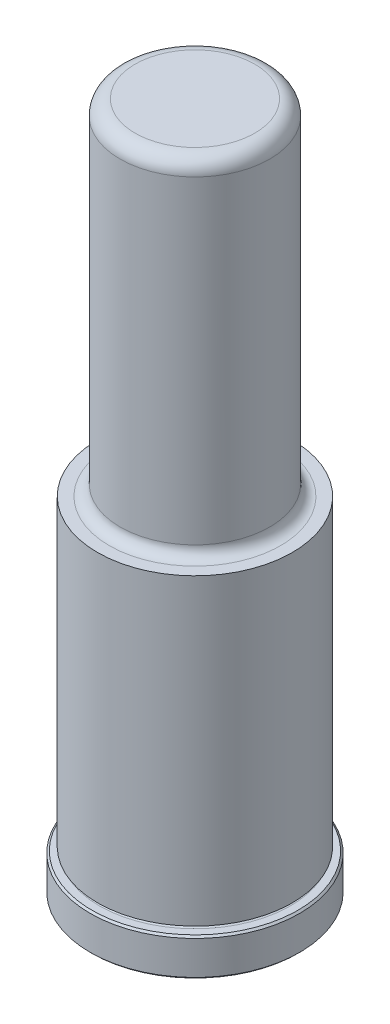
SolidWorks part; units mm, degrees
ref_plane "Front Plane" through (0, 0, 0) normal (0, 0, 1) x (1, 0, 0)
ref_plane "Top Plane" through (0, 0, 0) normal (0, 1, 0) x (1, 0, 0)
ref_plane "Right Plane" through (0, 0, 0) normal (1, 0, 0) x (0, 0, -1)
sketch "Sketch1" plane through (0, 0, 0) normal (1, 0, 0) x (0, 0, -1)
  line L0 (0, 0) -> (22.225, 0)
  line L1 (22.225, 0) -> (22.225, 7.9248)
  line L2 (22.225, 7.9248) -> (20.2438, 7.9248)
  line L3 (19.8628, 2.6782) -> (19.8628, 5.9795) construction
  line L4 (20.2438, 8.6868) -> (20.6502, 8.6868)
  line L5 (20.6502, 8.6868) -> (20.6502, 73.025)
  line L6 (20.6502, 73.025) -> (18.1483, 73.025)
  line L7 (15.8623, 75.311) -> (15.8623, 146.05)
  line L9 (15.8623, 146.05) -> (0, 146.05)
  line L10 (0, 146.05) -> (0, 0)
  line L11 (0, 0) -> (0, -7.2694) construction
  arc A0 (20.2438, 8.6868) -> (20.2438, 7.9248) centre (20.2438, 8.3058) ccw
  arc A1 (18.1483, 73.025) -> (15.8623, 75.311) centre (18.1483, 75.311) cw
  point P2 (15.8623, 146.05)
  point P14 (15.8623, 145.8335)
  point P19 (15.8623, 73.025)
  dimension "D14" = 0.762
  dimension "D8" = 2.286
  dimension "T" = 7.9248
  dimension "D2" = 0.762
  dimension "M" = 44.45
  dimension "B" = 41.3004
  dimension "L" = 146.05
  dimension "D7" = 0.7874
  dimension "A" = 73.025
  dimension "D" = 31.7246
  dimension "D15" = 73.025
revolve "Revolve1" add sketch "Sketch1" angle 360 about L11
chamfer "Chamfer1" distance 0.381 angle 45 2 edges at (0, 0, 22.225) (0, 7.9248, 22.225)
fillet "Fillet7" radius 3.175 1 edges at (0, 146.05, 15.8623)
